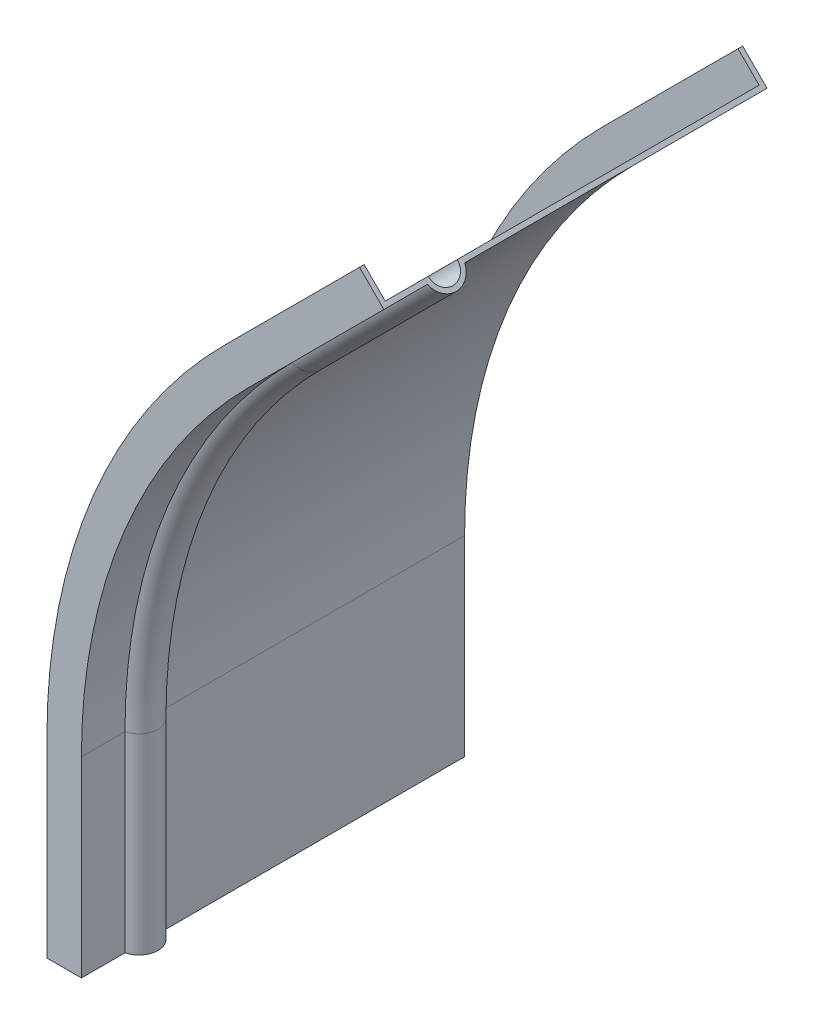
SolidWorks part; units mm, degrees
ref_plane "Front Plane" through (0, 0, 0) normal (0, 0, 1) x (1, 0, 0)
ref_plane "Top Plane" through (0, 0, 0) normal (0, 1, 0) x (1, 0, 0)
ref_plane "Right Plane" through (0, 0, 0) normal (1, 0, 0) x (0, 0, -1)
sketch "Sketch1" plane through (0, 0, 0) normal (0, 0, 1) x (1, 0, 0)
  line L0 (0, 0) -> (500, 0) construction
  line L1 (500, 0) -> (500, 50)
  line L2 (543.934, 156.066) -> (579.2893, 191.4214)
  line L3 (579.2893, 191.4214) -> (225.7359, 544.9747) construction
  line L4 (225.7359, 544.9747) -> (190.3806, 509.6194) construction
  line L5 (0, 50) -> (0, 0) construction
  arc A0 (500, 50) -> (543.934, 156.066) centre (650, 50) cw
  arc A1 (190.3806, 509.6194) -> (0, 50) centre (650, 50) ccw construction
  dimension "D2" = 50
  dimension "D3" = 150
  dimension "D1" = 45
  dimension "D4" = 500
sketch "Sketch2" plane through (0, 0, 0) normal (0, 1, 0) x (1, 0, 0)
  line L0 (501.214, 1.214) -> (492.214, 1.214)
  line L1 (501.214, 1.214) -> (501.214, -77.7216)
  line L2 (501.214, -87.4224) -> (501.214, -98.786)
  line L3 (501.214, -98.786) -> (492.214, -98.786)
  line L4 (492.214, -98.786) -> (492.214, -97.572)
  line L5 (492.214, -97.572) -> (500, -97.572)
  line L6 (500, -97.572) -> (500, -86.358)
  line L7 (500, -78.786) -> (500, 0)
  line L8 (500, 0) -> (492.214, 0)
  line L9 (492.214, 0) -> (492.214, 1.214)
  arc A0 (501.214, -77.7216) -> (501.214, -87.4224) centre (500, -82.572) cw
  arc A1 (500, -86.358) -> (500, -78.786) centre (500, -82.572) ccw
  dimension "D4" = 5
  dimension "D5" = 1.214
  dimension "D1" = 1.214
  dimension "D2" = 1.214
  dimension "D3" = 1.214
  dimension "D6" = 9
  dimension "D7" = 15
  dimension "D8" = 100
sweep "Sweep1" add profiles "Sketch2" path "Sketch1"
